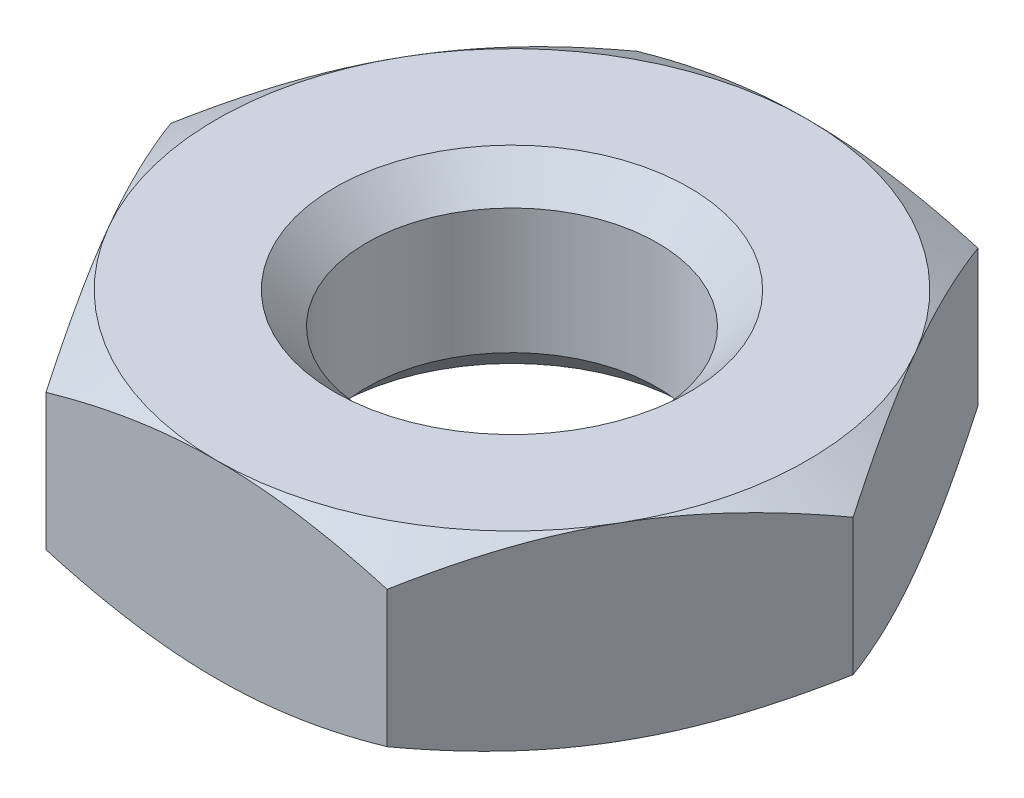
SolidWorks part; units mm, degrees
ref_plane "Plan de face" through (0, 0, 0) normal (0, 0, 1) x (1, 0, 0)
ref_plane "Plan de dessus" through (0, 0, 0) normal (0, 1, 0) x (1, 0, 0)
ref_plane "Plan de droite" through (0, 0, 0) normal (1, 0, 0) x (0, 0, -1)
imported_body "Importée3"
hole_wizard "Perçage1" positions "Esquisse2" profile "Esquisse1" legacy
sketch "Esquisse2" plane through (0, 3.2, 0) normal (0, 1, 0) x (-1, 0, 0)
  point P0 (0, 0)
sketch "Esquisse1" plane through (0, 3.2, 0) normal (1, 0, 0) x (0, 0, 1)
  line L0 (0, 0) -> (0, 3.2)
  line L1 (0, 3.2) -> (2.46, 3.2)
  line L2 (2.46, 3.2) -> (2.46, 0)
  line L3 (2.46, 0) -> (0, 0)
  line L4 (0, 110) -> (0, -10) construction
  dimension "Diamètre" = 4.92
  dimension "Profondeur" = 3.2
chamfer "Chanfrein1" distance 0.54 angle 45 1 edges at (0, 3.2, 2.46)
chamfer "Chanfrein2" distance 0.54 angle 45 1 edges at (0, 0, 2.46)
